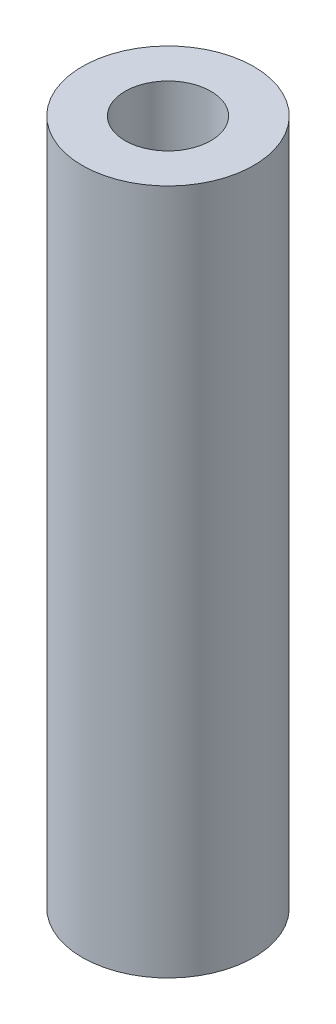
SolidWorks part; units mm, degrees
ref_plane "Front Plane" through (0, 0, 0) normal (0, 0, 1) x (1, 0, 0)
ref_plane "Top Plane" through (0, 0, 0) normal (0, 1, 0) x (1, 0, 0)
ref_plane "Right Plane" through (0, 0, 0) normal (1, 0, 0) x (0, 0, -1)
sketch "Sketch1" plane through (0, 0, 0) normal (0, 1, 0) x (1, 0, 0)
  circle A0 centre (0, 0) radius 3.175
  circle A1 centre (0, 0) radius 1.5875
  dimension "D1" = 3.175
  dimension "D2" = 6.35
sketch "Sketch2" plane through (0, 0, 0) normal (0, 0, 1) x (1, 0, 0)
  line L0 (0, 0) -> (0, 25.4)
  dimension "D1" = 25.4
sweep "Sweep1" add profiles "Sketch1" path "Sketch2"
